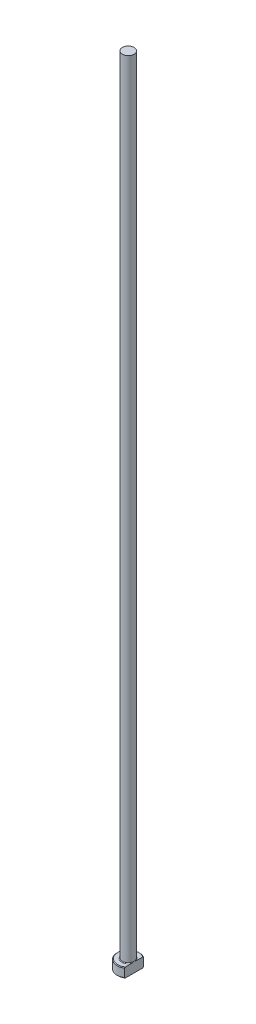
SolidWorks part; units mm, degrees
ref_plane "Front Plane" through (0, 0, 0) normal (0, 0, 1) x (1, 0, 0)
ref_plane "Top Plane" through (0, 0, 0) normal (0, 1, 0) x (1, 0, 0)
ref_plane "Right Plane" through (0, 0, 0) normal (1, 0, 0) x (0, 0, -1)
sketch "Sketch1" plane through (0, 0, 0) normal (0, 0, 1) x (1, 0, 0)
  line L0 (0, 259.9588) -> (0, -15.1925) construction
  line L1 (0, 0) -> (-3.5, 0)
  line L2 (-3.5, 0) -> (-3.5, 3)
  line L3 (-3.5, 3) -> (-1.85, 3)
  line L4 (-1.85, 3) -> (-1.85, 250)
  line L5 (-1.85, 250) -> (0, 250)
  line L6 (0, 250) -> (0, 0)
  dimension "L" = 250
  dimension "H" = 7
  dimension "T" = 3
  dimension "D" = 3.7
revolve "Revolve1" add sketch "Sketch1" angle 360 about L0
chamfer "Chamfer1" distance 0.2 angle 45 2 edges at (0, 3, 3.5) (0, 0, 3.5)
fillet "Fillet1" radius 0.2 1 edges at (0, 3, 1.85)
sketch "Sketch2" plane through (0, 0, 0) normal (0, 1, 0) x (1, 0, 0)
  line L0 (1.85, 2.9711) -> (1.85, -2.9711)
  circle A0 centre (0, 0) radius 3.5 construction
  arc A1 (1.85, -2.9711) -> (1.85, 2.9711) centre (0, 0) ccw
  circle A2 centre (0, 0) radius 1.85 construction
extrude "KEY" cut sketch "Sketch2" along normal through all
